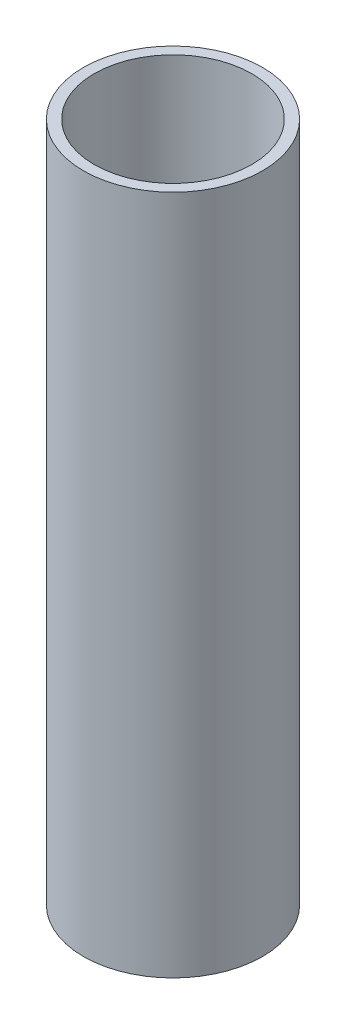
SolidWorks part; units mm, degrees
ref_plane "前视基准面" through (0, 0, 0) normal (0, 0, 1) x (1, 0, 0)
ref_plane "上视基准面" through (0, 0, 0) normal (0, 1, 0) x (1, 0, 0)
ref_plane "右视基准面" through (0, 0, 0) normal (1, 0, 0) x (0, 0, -1)
sketch "草图1" plane through (0, 0, 0) normal (0, 1, 0) x (1, 0, 0)
  circle A0 centre (0, 0) radius 25
  circle A1 centre (0, 0) radius 22
  dimension "D1" = 50
  dimension "D2" = 3
extrude "凸台-拉伸1" add sketch "草图1" along normal blind 190
